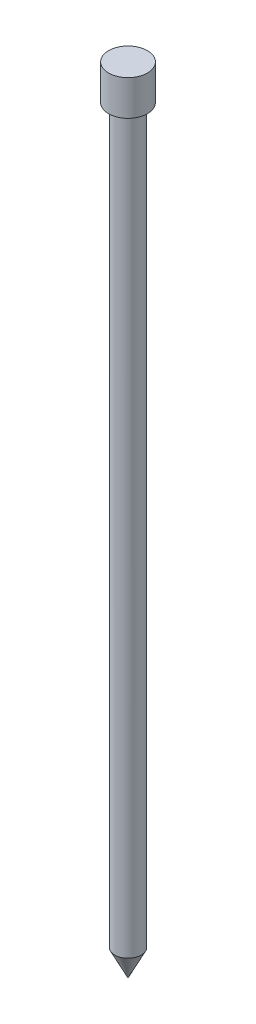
SolidWorks part; units mm, degrees
ref_plane "前视基准面" through (0, 0, 0) normal (0, 0, 1) x (1, 0, 0)
ref_plane "上视基准面" through (0, 0, 0) normal (0, 1, 0) x (1, 0, 0)
ref_plane "右视基准面" through (0, 0, 0) normal (1, 0, 0) x (0, 0, -1)
sketch "草图1" plane through (0, 0, 0) normal (0, 0, 1) x (1, 0, 0)
  line L0 (-0.75, 1.5) -> (0, 0)
  line L1 (-1.1, 45) -> (0, 45)
  line L2 (-1.1, 43) -> (-1.1, 45)
  line L3 (-1.1, 43) -> (-0.75, 43)
  line L4 (-0.75, 1.5) -> (-0.75, 43)
  line L5 (0, 0) -> (0, 55.7623) construction
  line L6 (0, 45) -> (0, 0)
revolve "旋转1" add sketch "草图1" angle 360 about L5
